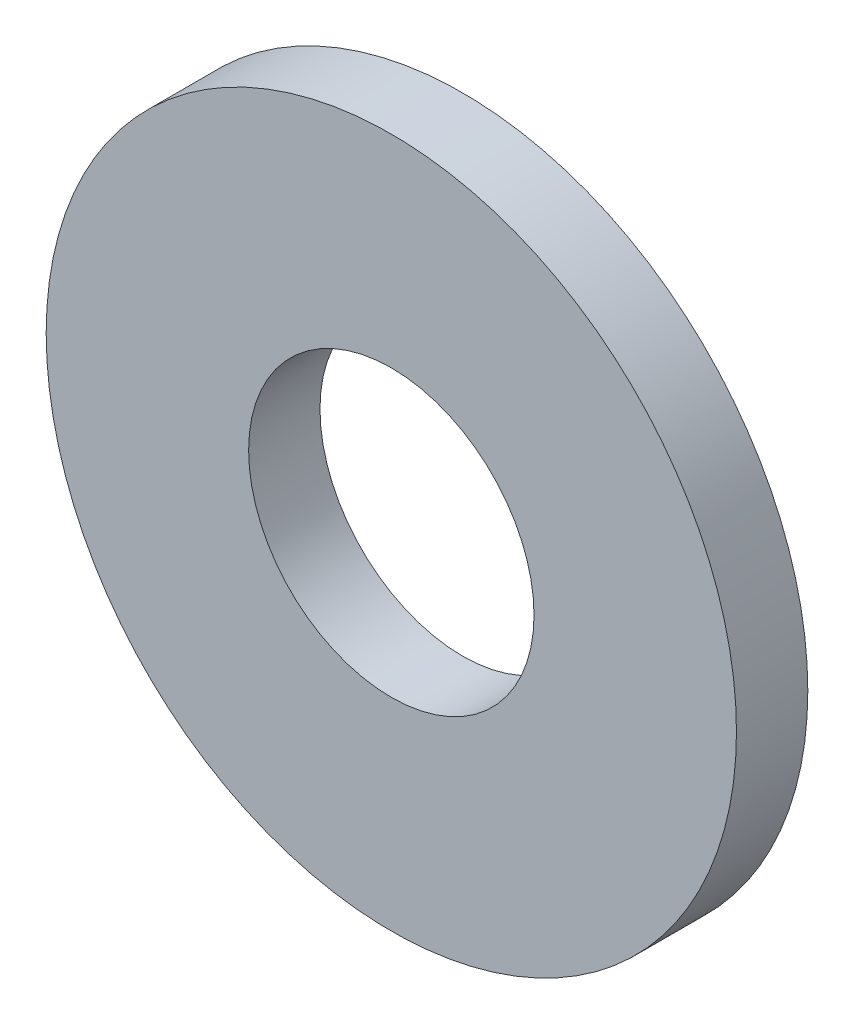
SolidWorks part; units mm, degrees
ref_plane "Front Plane" through (0, 0, 0) normal (0, 0, 1) x (1, 0, 0)
ref_plane "Top Plane" through (0, 0, 0) normal (0, 1, 0) x (1, 0, 0)
ref_plane "Right Plane" through (0, 0, 0) normal (1, 0, 0) x (0, 0, -1)
sketch "Sketch1" plane through (0, 0, 0) normal (0, 0, 1) x (1, 0, 0)
  circle A0 centre (0, 0) radius 4.9149
  circle A1 centre (0, 0) radius 2.032
  dimension "D1" = 4.064
  dimension "D2" = 9.8298
extrude "Boss-Extrude1" add sketch "Sketch1" along normal blind 1.016
